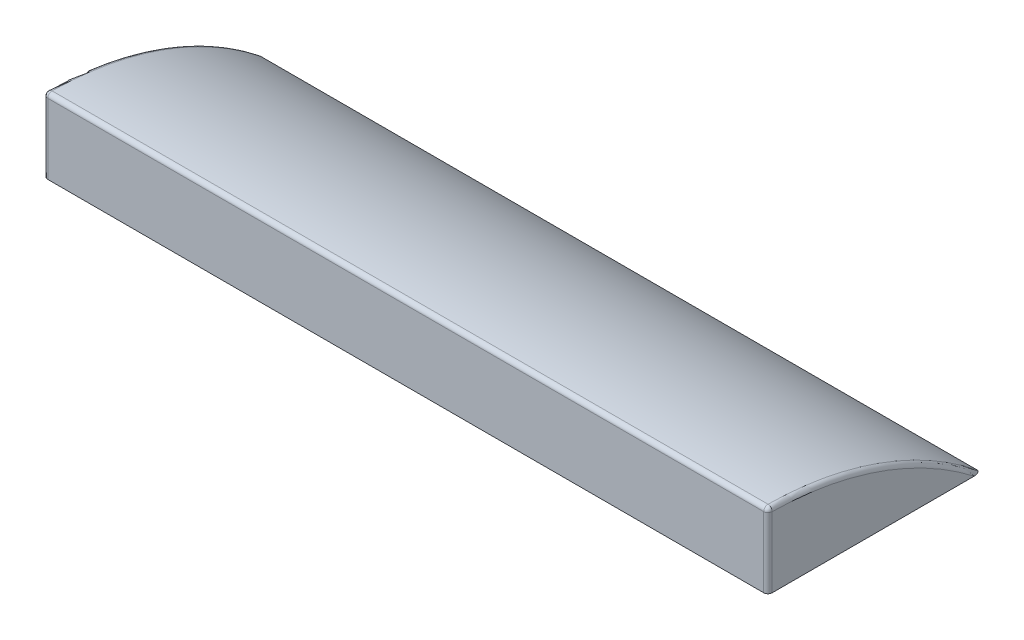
SolidWorks part; units mm, degrees
ref_plane "Plan de face" through (0, 0, 0) normal (0, 0, 1) x (1, 0, 0)
ref_plane "Plan de dessus" through (0, 0, 0) normal (0, 1, 0) x (1, 0, 0)
ref_plane "Plan de droite" through (0, 0, 0) normal (1, 0, 0) x (0, 0, -1)
sketch "Esquisse1" plane through (0, 0, 0) normal (1, 0, 0) x (0, 0, -1)
  line L0 (0, 0) -> (500, 0)
  line L1 (500, 0) -> (0, 175) construction
  line L2 (0, 0) -> (0, 175)
  arc A0 (500, 0) -> (0, 175) centre (0.6251, -624.9998) ccw
  dimension "D4" = 175
  dimension "D3" = 800
  dimension "D1" = 90
  dimension "D2" = 500
extrude "Boss.-Extru.1" add sketch "Esquisse1" along normal mid plane 1700
sketch "Esquisse2" plane through (0, 0, 0) normal (0, -1, 0) x (1, 0, 0)
  line L0 (0, -500) -> (0, 0) construction
  line L1 (850, -500) -> (-850, -500) construction
  line L2 (850, 0) -> (-850, 0) construction
  line L3 (0, -250) -> (258.9561, -250) construction
  circle A0 centre (-250, -250) radius 5
  circle A1 centre (250, -250) radius 5
  dimension "D1" = 250
extrude "Enlèv. mat.-Extru.1" cut sketch "Esquisse2" against normal blind 10
fillet "Congé1" radius 10 5 edges at (850, 87.5, 0) (-850, 87.5, 0) (-850, 130.0869, -264.9054) (850, 130.0869, -264.9054) (0, 175, 0)
